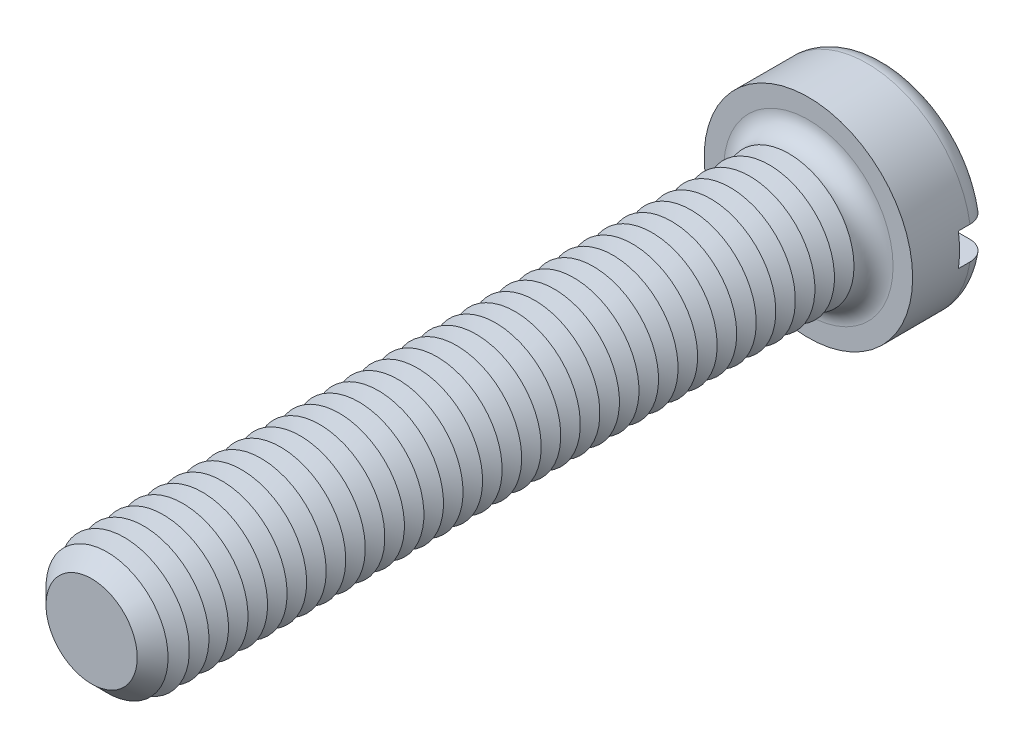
SolidWorks part; units mm, degrees
ref_plane "Front Plane" through (0, 0, 0) normal (0, 0, 1) x (1, 0, 0)
ref_plane "Top Plane" through (0, 0, 0) normal (0, 1, 0) x (1, 0, 0)
ref_plane "Right Plane" through (0, 0, 0) normal (1, 0, 0) x (0, 0, -1)
sketch "Sketch3" plane through (0, 0, 0) normal (0, 0, 1) x (1, 0, 0)
  circle A0 centre (0, 0) radius 8
  dimension "D1" = 16
extrude "Boss-Extrude2" add sketch "Sketch3" against normal blind 6
sketch "Sketch4" plane through (0, 0, 0) normal (0, 0, 1) x (1, 0, 0)
  circle A0 centre (0, 0) radius 5
  dimension "D1" = 10
extrude "Boss-Extrude3" add sketch "Sketch4" along normal blind 55
fillet "Fillet1" radius 1.5 2 edges at (8, 0, -6) (5, 0, 0)
chamfer "Chamfer1" distance 1.5 angle 45 1 edges at (5, 0, 55)
sketch "Sketch5" plane through (0, 0, 0) normal (1, 0, 0) x (0, 0, -1)
  line L0 (1.6944, 0) -> (-7.6738, 0) construction
sketch "Sketch6" plane through (0, 0, 0) normal (1, 0, 0) x (0, 0, -1)
  line L0 (-1.5, 5) -> (-2.25, 3.701)
  line L1 (-2.25, 3.701) -> (-3, 5)
  line L2 (-1.5, 5) -> (-53.5, 5) construction
  line L3 (-3, 5) -> (-1.5, 5)
  dimension "D1" = 1.5
revolve "Cut-Revolve1" cut sketch "Sketch6" angle 360 about L0
pattern_linear "LPattern1" count 35 spacing 1.5 along (0, 0, 1) of "Cut-Revolve1"
sketch "Sketch8" plane through (0, 0, -6) normal (0, 0, -1) x (-1, 0, 0)
  line L1 (8, -1.25) -> (-8, -1.25)
  line L2 (8, -1.25) -> (8, 1.25)
  line L3 (8, 1.25) -> (-8, 1.25)
  line L4 (-8, -1.25) -> (-8, 1.25)
  line L5 (8, -1.25) -> (-8, 1.25) construction
  line L6 (8, 1.25) -> (-8, -1.25) construction
  point P0 (0, 0)
  dimension "D1" = 16
  dimension "D2" = 2.5
extrude "Cut-Extrude1" cut sketch "Sketch8" against normal blind 2.4
